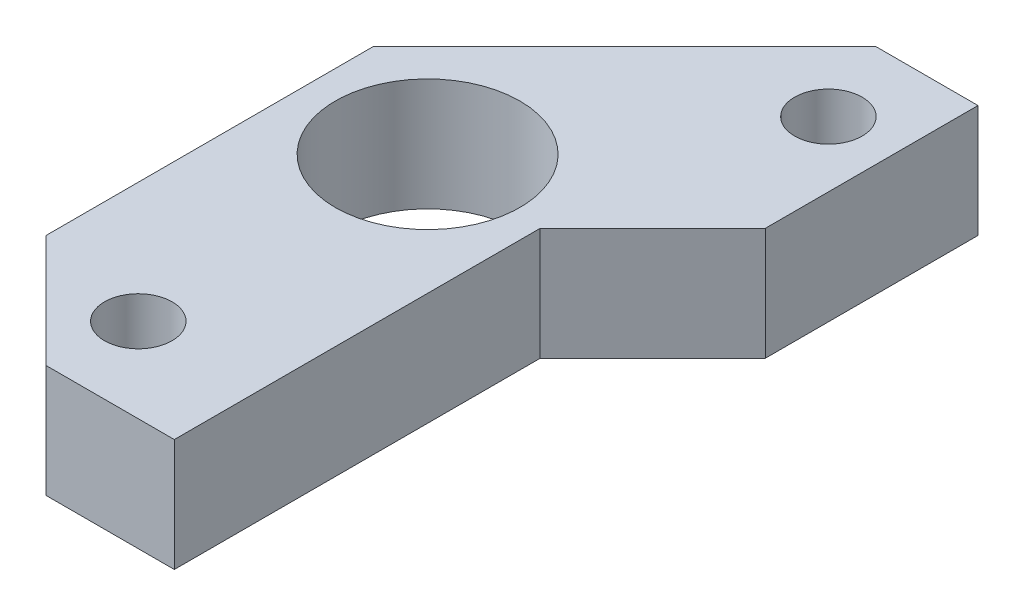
SolidWorks part; units mm, degrees
ref_plane "Front Plane" through (0, 0, 0) normal (0, 0, 1) x (1, 0, 0)
ref_plane "Top Plane" through (0, 0, 0) normal (0, 1, 0) x (1, 0, 0)
ref_plane "Right Plane" through (0, 0, 0) normal (1, 0, 0) x (0, 0, -1)
sketch "Sketch6" plane through (0, 0, 0) normal (0, 1, 0) x (1, 0, 0)
  line L6 (43.22, -13.28) -> (47.78, -13.28)
  line L8 (39.22, -9.28) -> (39.22, 2.3532)
  line L10 (47.78, -0.28) -> (47.78, -13.28)
  line L12 (43.22, -13.28) -> (39.22, -9.28)
  line L15 (51.78, 11.28) -> (51.78, 3.72)
  line L17 (39.22, 2.3532) -> (48.1468, 11.28)
  line L18 (48.1468, 11.28) -> (51.78, 11.28)
  line L20 (47.78, -0.28) -> (51.78, 3.72)
  circle A0 centre (49.4634, 8.28) radius 1.2
  circle A4 centre (43.5, -10.28) radius 1.2
  circle A10 centre (43.5, 0) radius 3.28
  point P24 (39.22, -13.28)
  point P25 (47.78, -13.28)
extrude "Boss-Extrude4" add sketch "Sketch6" along normal blind 4
